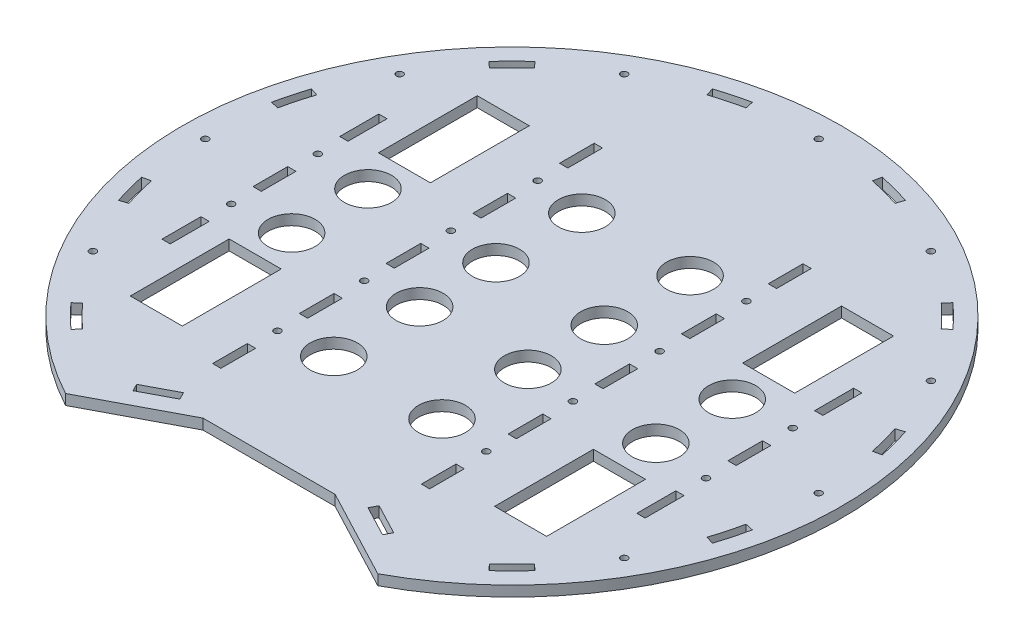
SolidWorks part; units mm, degrees
ref_plane "Front Plane" through (0, 0, 0) normal (0, 0, 1) x (1, 0, 0)
ref_plane "Top Plane" through (0, 0, 0) normal (0, 1, 0) x (1, 0, 0)
ref_plane "Right Plane" through (0, 0, 0) normal (1, 0, 0) x (0, 0, -1)
sketch "Sketch1" plane through (0, 0, 0) normal (0, 1, 0) x (1, 0, 0)
  line L0 (-104.8327, -158.4617) -> (-38.7298, -123.65) construction
  line L1 (-120, -100.0099) -> (-90, -100.0099)
  line L2 (-120, -100.0099) -> (-120, -43.0099)
  line L3 (-120, -43.0099) -> (-90, -43.0099)
  line L4 (-90, -100.0099) -> (-90, -43.0099)
  line L5 (-120, 43.0099) -> (-90, 43.0099)
  line L6 (-120, 43.0099) -> (-120, 100.0099)
  line L7 (-120, 100.0099) -> (-90, 100.0099)
  line L8 (-90, 43.0099) -> (-90, 100.0099)
  line L9 (90, 100.0099) -> (120, 100.0099)
  line L10 (90, 100.0099) -> (90, 43.0099)
  line L11 (90, 43.0099) -> (120, 43.0099)
  line L12 (120, 100.0099) -> (120, 43.0099)
  line L13 (120, -43.0099) -> (90, -43.0099)
  line L14 (120, -43.0099) -> (120, -100.0099)
  line L15 (120, -100.0099) -> (90, -100.0099)
  line L16 (90, -43.0099) -> (90, -100.0099)
  line L17 (-38.7298, -123.65) -> (38.7298, -123.65) construction
  line L18 (0, 190) -> (0, -190) construction
  line L19 (-105, 43.0099) -> (-105, -43.0099) construction
  line L20 (-190, 0) -> (190, 0) construction
  line L33 (139.2625, -40) -> (139.2625, -62.4969)
  line L34 (-134.5, 40) -> (-139.2625, 40)
  line L35 (-134.5, 40) -> (-134.5, 62.4969)
  line L36 (-134.5, 62.4969) -> (-139.2625, 62.4969)
  line L37 (-139.2625, 40) -> (-139.2625, 62.4969)
  line L38 (-134.5, 10) -> (-139.2625, 10)
  line L39 (-134.5, 10) -> (-134.5, -10)
  line L40 (-134.5, -10) -> (-139.2625, -10)
  line L41 (-139.2625, 10) -> (-139.2625, -10)
  line L46 (-134.5, -40) -> (-139.2625, -40)
  line L47 (-134.5, -40) -> (-134.5, -62.4969)
  line L48 (-134.5, -62.4969) -> (-139.2625, -62.4969)
  line L49 (-139.2625, -40) -> (-139.2625, -62.4969)
  line L50 (134.5, -62.4969) -> (139.2625, -62.4969)
  line L51 (134.5, -40) -> (134.5, -62.4969)
  line L52 (134.5, -40) -> (139.2625, -40)
  line L53 (139.2625, 10) -> (139.2625, -10)
  line L54 (134.5, -10) -> (139.2625, -10)
  line L55 (134.5, 10) -> (134.5, -10)
  line L56 (134.5, 10) -> (139.2625, 10)
  line L57 (139.2625, 40) -> (139.2625, 62.4969)
  line L58 (134.5, 62.4969) -> (139.2625, 62.4969)
  line L59 (134.5, 40) -> (134.5, 62.4969)
  line L60 (134.5, 40) -> (139.2625, 40)
  line L73 (38.7298, -123.65) -> (104.8327, -158.4617) construction
  line L86 (0, 0) -> (-37.4241, 176.0666) construction
  line L99 (-155.3051, -190) -> (147.1552, -190) construction
  line L100 (-128.4523, -140) -> (128.4523, -140) construction
  line L101 (-90, -167.332) -> (-38.1, -140)
  line L102 (-38.1, -140) -> (38.1, -140)
  line L103 (38.1, -140) -> (90, -167.332)
  line L104 (-54.1521, 166.6631) -> (-55.6231, 171.1902)
  line L105 (0, 0) -> (-55.6231, 171.1902) construction
  line L126 (105, 43.0099) -> (105, -43.0099) construction
  line L127 (-37.4241, 176.0666) -> (-36.4344, 171.4106)
  line L128 (-100.2255, -161.4151) -> (-40.5722, -130) construction
  line L129 (-120.4435, 133.7661) -> (-117.2584, 130.2287)
  line L130 (-40.5722, -130) -> (40.5722, -130) construction
  line L131 (40.5722, -130) -> (100.2255, -161.4151) construction
  line L132 (-130.2287, 117.2584) -> (-133.7661, 120.4435)
  line L133 (-171.1902, 55.6231) -> (-166.6631, 54.1521)
  line L134 (-171.4106, 36.4344) -> (-176.0666, 37.4241)
  line L135 (-176.0666, -37.4241) -> (-171.4106, -36.4344)
  line L136 (-166.6631, -54.1521) -> (-171.1902, -55.6231)
  line L137 (-133.7661, -120.4435) -> (-130.2287, -117.2584)
  line L138 (-117.2584, -130.2287) -> (-120.4435, -133.7661)
  line L139 (0, 0) -> (-36.4344, 171.4106) construction
  line L140 (57.7908, -10) -> (62.5533, -10)
  line L141 (117.2584, -130.2287) -> (120.4435, -133.7661)
  line L142 (133.7661, -120.4435) -> (130.2287, -117.2584)
  line L143 (166.6631, -54.1521) -> (171.1902, -55.6231)
  line L144 (176.0666, -37.4241) -> (171.4106, -36.4344)
  line L145 (171.4106, 36.4344) -> (176.0666, 37.4241)
  line L146 (171.1902, 55.6231) -> (166.6631, 54.1521)
  line L147 (130.2287, 117.2584) -> (133.7661, 120.4435)
  line L148 (120.4435, 133.7661) -> (117.2584, 130.2287)
  line L149 (37.4241, 176.0666) -> (36.4344, 171.4106)
  line L150 (54.1521, 166.6631) -> (55.6231, 171.1902)
  line L151 (-54.2079, -137.1809) -> (-56.4259, -132.9693)
  line L152 (-56.4259, -132.9693) -> (-74.1219, -142.2885)
  line L153 (-74.1219, -142.2885) -> (-71.904, -146.5002)
  line L154 (-71.904, -146.5002) -> (-54.2079, -137.1809)
  line L155 (74.1219, -142.2885) -> (71.904, -146.5002)
  line L156 (71.904, -146.5002) -> (54.2079, -137.1809)
  line L157 (54.2079, -137.1809) -> (56.4259, -132.9693)
  line L158 (56.4259, -132.9693) -> (74.1219, -142.2885)
  line L159 (-62.5533, 40) -> (-57.7908, 40)
  line L164 (-57.7908, 10) -> (-62.5533, 10)
  line L165 (-57.7908, 10) -> (-57.7908, -10)
  line L166 (-57.7908, -10) -> (-62.5533, -10)
  line L167 (-62.5533, 10) -> (-62.5533, -10)
  line L168 (-62.5533, 40) -> (-62.5533, 60)
  line L169 (-62.5533, 60) -> (-57.7908, 60)
  line L170 (-57.7908, 40) -> (-57.7908, 60)
  line L171 (-62.5533, 90) -> (-57.7908, 90)
  line L172 (-62.5533, 90) -> (-62.5533, 110)
  line L173 (-62.5533, 110) -> (-57.7908, 110)
  line L174 (-57.7908, 90) -> (-57.7908, 110)
  line L175 (-62.5533, -40) -> (-57.7908, -40)
  line L176 (-62.5533, -40) -> (-62.5533, -60)
  line L177 (-62.5533, -60) -> (-57.7908, -60)
  line L178 (-57.7908, -40) -> (-57.7908, -60)
  line L179 (-62.5533, -90) -> (-57.7908, -90)
  line L180 (-62.5533, -90) -> (-62.5533, -110)
  line L181 (-62.5533, -110) -> (-57.7908, -110)
  line L182 (-57.7908, -90) -> (-57.7908, -110)
  line L183 (62.5533, -60) -> (57.7908, -60)
  line L184 (57.7908, -40) -> (57.7908, -60)
  line L185 (62.5533, -40) -> (62.5533, -60)
  line L186 (62.5533, -40) -> (57.7908, -40)
  line L187 (62.5533, -110) -> (57.7908, -110)
  line L188 (62.5533, -90) -> (57.7908, -90)
  line L189 (57.7908, -90) -> (57.7908, -110)
  line L190 (62.5533, -90) -> (62.5533, -110)
  line L191 (57.7908, 90) -> (57.7908, 110)
  line L192 (62.5533, 110) -> (57.7908, 110)
  line L193 (62.5533, 90) -> (62.5533, 110)
  line L194 (62.5533, 90) -> (57.7908, 90)
  line L195 (57.7908, 40) -> (57.7908, 60)
  line L196 (62.5533, 60) -> (57.7908, 60)
  line L197 (62.5533, 40) -> (62.5533, 60)
  line L198 (62.5533, 10) -> (62.5533, -10)
  line L199 (57.7908, 10) -> (57.7908, -10)
  line L200 (57.7908, 10) -> (62.5533, 10)
  line L201 (62.5533, 40) -> (57.7908, 40)
  line L202 (-134.5, -62.4969) -> (-134.5, -112.3335) construction
  line L203 (-134.5, 62.4969) -> (-134.5, 112.3335) construction
  line L204 (-57.7908, 110) -> (-57.7908, 165.4366) construction
  line L205 (-57.7908, -110) -> (-57.7908, -133.6881) construction
  line L206 (-136.8813, 40) -> (-136.8813, 10) construction
  line L207 (-136.8813, -10) -> (-136.8813, -40) construction
  line L208 (-60.1721, 40) -> (-60.1721, 10) construction
  line L209 (-60.1721, -10) -> (-60.1721, -40) construction
  line L210 (-60.1721, -60) -> (-60.1721, -90) construction
  line L211 (-60.1721, 90) -> (-60.1721, 60) construction
  line L212 (0, 178.4244) -> (0, 175.24) construction
  line L213 (0, 0) -> (0, 176.8322) construction
  line L214 (0, 0) -> (88.4161, 153.1412) construction
  circle A0 centre (0, 0) radius 190 construction
  arc A3 (-90, -167.332) -> (90, -167.332) centre (0, 0) cw
  circle A4 centre (-105, -22.0099) radius 13.5729
  circle A5 centre (-105, 22.0099) radius 13.5729
  circle A6 centre (105, 22.0099) radius 13.5729
  circle A7 centre (105, -22.0099) radius 13.5729
  circle A16 centre (0, 0) radius 180 construction
  circle A17 centre (0, 0) radius 175.24 construction
  arc A18 (-55.6231, 171.1902) -> (-37.4241, 176.0666) centre (0, 0) cw
  arc A19 (-54.1521, 166.6631) -> (-36.4344, 171.4106) centre (0, 0) cw
  arc A20 (-133.7661, 120.4435) -> (-120.4435, 133.7661) centre (0, 0) cw
  arc A21 (-130.2287, 117.2584) -> (-117.2584, 130.2287) centre (0, 0) cw
  arc A22 (-176.0666, 37.4241) -> (-171.1902, 55.6231) centre (0, 0) cw
  arc A23 (-171.4106, 36.4344) -> (-166.6631, 54.1521) centre (0, 0) cw
  arc A24 (-171.1902, -55.6231) -> (-176.0666, -37.4241) centre (0, 0) cw
  arc A25 (-166.6631, -54.1521) -> (-171.4106, -36.4344) centre (0, 0) cw
  arc A26 (-120.4435, -133.7661) -> (-133.7661, -120.4435) centre (0, 0) cw
  arc A27 (-117.2584, -130.2287) -> (-130.2287, -117.2584) centre (0, 0) cw
  arc A28 (120.4435, -133.7661) -> (133.7661, -120.4435) centre (0, 0) ccw
  arc A29 (117.2584, -130.2287) -> (130.2287, -117.2584) centre (0, 0) ccw
  arc A30 (166.6631, -54.1521) -> (171.4106, -36.4344) centre (0, 0) ccw
  arc A31 (171.1902, -55.6231) -> (176.0666, -37.4241) centre (0, 0) ccw
  arc A32 (176.0666, 37.4241) -> (171.1902, 55.6231) centre (0, 0) ccw
  arc A33 (171.4106, 36.4344) -> (166.6631, 54.1521) centre (0, 0) ccw
  arc A34 (133.7661, 120.4435) -> (120.4435, 133.7661) centre (0, 0) ccw
  arc A35 (130.2287, 117.2584) -> (117.2584, 130.2287) centre (0, 0) ccw
  arc A36 (54.1521, 166.6631) -> (36.4344, 171.4106) centre (0, 0) ccw
  arc A37 (55.6231, 171.1902) -> (37.4241, 176.0666) centre (0, 0) ccw
  circle A38 centre (-31.2033, 22.0099) radius 13.5729
  circle A39 centre (-31.2033, 71.5099) radius 13.5729
  circle A40 centre (-31.2033, -22.0099) radius 13.5729
  circle A41 centre (-31.2033, -71.5099) radius 13.5729
  circle A42 centre (31.2033, -71.5099) radius 13.5729
  circle A43 centre (31.2033, -22.0099) radius 13.5729
  circle A44 centre (31.2033, 71.5099) radius 13.5729
  circle A45 centre (31.2033, 22.0099) radius 13.5729
  circle A47 centre (-60.1721, 75) radius 1.9558
  circle A48 centre (-60.1721, 25) radius 1.9558
  circle A49 centre (-136.8813, 25) radius 1.9558
  circle A50 centre (-136.8813, -25) radius 1.9558
  circle A51 centre (-60.1721, -25) radius 1.9558
  circle A52 centre (-60.1721, -75) radius 1.9558
  circle A53 centre (0, 176.8322) radius 1.9558
  circle A54 centre (88.4161, 153.1412) radius 1.9558
  circle A55 centre (153.1412, 88.4161) radius 1.9558
  circle A56 centre (176.8322, 0) radius 1.9558
  circle A57 centre (153.1412, -88.4161) radius 1.9558
  circle A58 centre (-88.4161, 153.1412) radius 1.9558
  circle A59 centre (-153.1412, 88.4161) radius 1.9558
  circle A60 centre (-176.8322, 0) radius 1.9558
  circle A61 centre (-153.1412, -88.4161) radius 1.9558
  circle A62 centre (60.1721, 75) radius 1.9558
  circle A63 centre (60.1721, 25) radius 1.9558
  circle A64 centre (60.1721, -75) radius 1.9558
  circle A65 centre (60.1721, -25) radius 1.9558
  circle A66 centre (136.8813, -25) radius 1.9558
  circle A67 centre (136.8813, 25) radius 1.9558
  point P71 (-60.1721, 90)
  point P116 (0, -140)
  point P166 (-90, -71.5099)
  point P168 (-90, 71.5099)
  point P199 (-57.7908, 0)
  dimension "D1" = 380
  dimension "D5" = 90
  dimension "D25" = 27.1458
  dimension "D30" = 360
  dimension "D31" = 350.48
  dimension "D38" = 20
  dimension "D40" = 3.9116
  dimension "D3" = 30
  dimension "D4" = 57
  dimension "D6" = 4.7625
  dimension "D7" = 71.9467
  dimension "D8" = 20
  dimension "D9" = 30
  dimension "D10" = 30
  dimension "D11" = 30
  dimension "D12" = 14.5
  dimension "D13" = 200.0199
  dimension "D14" = 100.0099
  dimension "D15" = 90
  dimension "D16" = 4.76
  dimension "D17" = 50
  dimension "D18" = 76.2
  dimension "D19" = 4.76
  dimension "D20" = 6.35
  dimension "D21" = 30
  dimension "D22" = 30
  dimension "D23" = 55.4366
  dimension "D24" = 49.8366
  dimension "D26" = 21
  dimension "D27" = 21
  dimension "D28" = 6
  dimension "D29" = 12
  dimension "D32" = 10
  dimension "D33" = 10
  dimension "D34" = 10
  dimension "D35" = 5
  dimension "D36" = 49.8366
  dimension "D37" = 23.6881
  dimension "D39" = 20
  dimension "D41" = 20
  dimension "D43" = 30
  dimension "D42" = 5
extrude "Boss-Extrude1" add sketch "Sketch1" along normal blind 6
